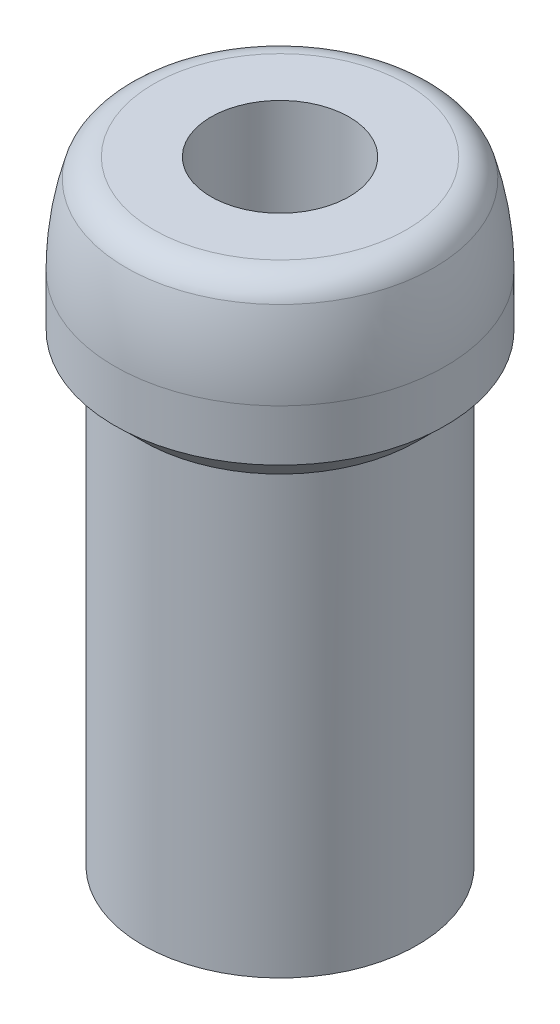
SolidWorks part; units mm, degrees
ref_plane "Přední rovina" through (0, 0, 0) normal (0, 0, 1) x (1, 0, 0)
ref_plane "Horní rovina" through (0, 0, 0) normal (0, 1, 0) x (1, 0, 0)
ref_plane "Pravá rovina" through (0, 0, 0) normal (1, 0, 0) x (0, 0, -1)
sketch "Skica1" plane through (0, 0, 0) normal (0, 1, 0) x (1, 0, 0)
  circle A0 centre (0, 0) radius 6.95
  dimension "D1" = 13.9
extrude "Přidat vysunutím1" add sketch "Skica1" along normal blind 23.5
sketch "Skica3" plane through (0, 0, 0) normal (0, 0, 1) x (1, 0, 0)
  line L0 (0, 23.5) -> (-8.3776, 23.5)
  line L1 (6.95, 23.5) -> (-6.95, 23.5) construction
  line L2 (-8.3776, 23.5) -> (-8.3776, 26.1)
  line L3 (-6.4, 31.1) -> (0, 31.1)
  line L4 (0, 31.1) -> (0, 23.5) construction
  line L5 (0, 23.5) -> (0, 31.1)
  arc A0 (-8.3776, 26.1) -> (-7.8, 30.1385) centre (5.6223, 26.1584) cw
  arc A1 (-7.8, 30.1385) -> (-6.4, 31.1) centre (-6.4, 29.6) cw
  dimension "D3" = 14
  dimension "D7" = 1.5
  dimension "D1" = 7.8
  dimension "D2" = 2.6
  dimension "D4" = 6.4
  dimension "D5" = 7.6
  dimension "D6" = 7.6
revolve "Rotovat1" add sketch "Skica3" angle 360 about L4
chamfer "Zkosení1" distance 1.4 angle 45 1 edges at (0, 23.5, 6.95)
sketch "Skica4" plane through (0, 0, 0) normal (0, -1, 0) x (1, 0, 0)
  circle A0 centre (0, 0) radius 3.5
extrude "Odebrat vysunutím1" cut sketch "Skica4" against normal through all
